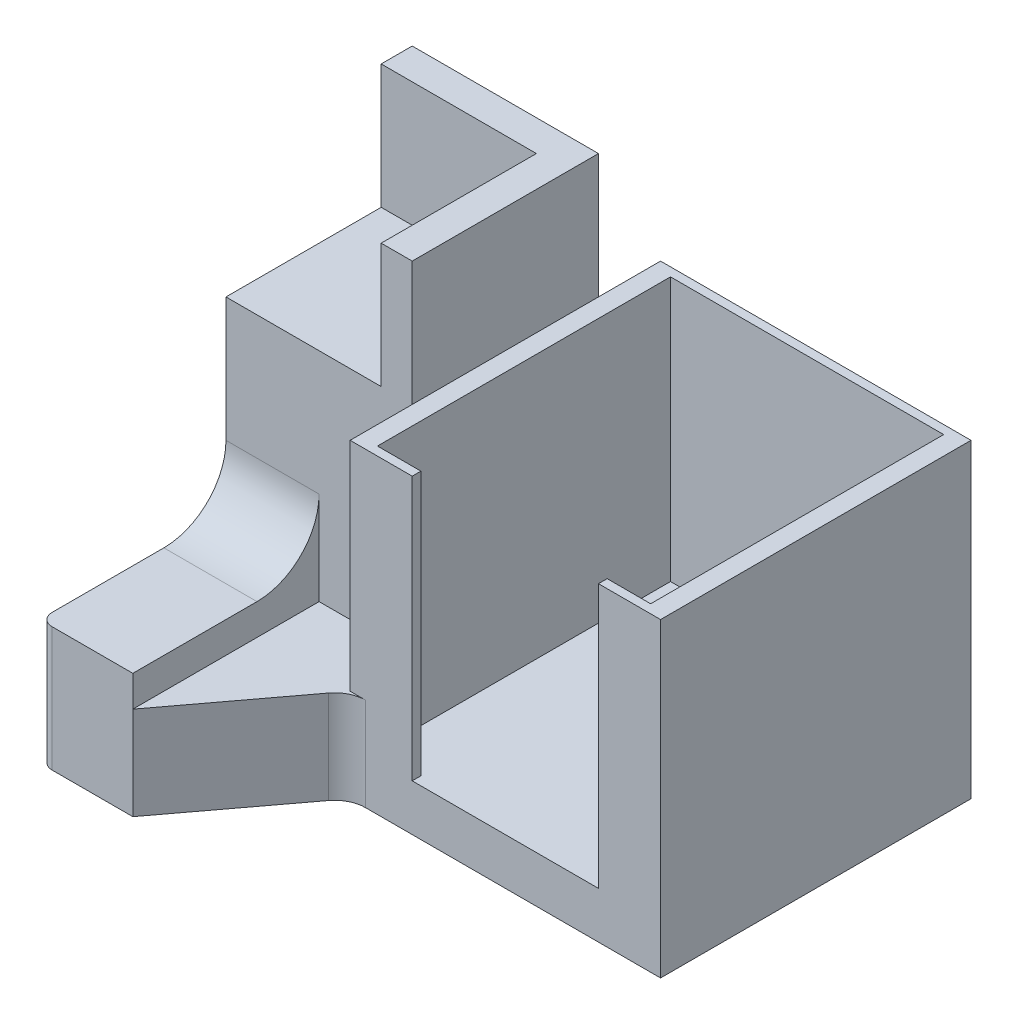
SolidWorks part; units mm, degrees
ref_plane "Alzado" through (0, 0, 0) normal (0, 0, 1) x (1, 0, 0)
ref_plane "Planta" through (0, 0, 0) normal (0, 1, 0) x (1, 0, 0)
ref_plane "Vista lateral" through (0, 0, 0) normal (1, 0, 0) x (0, 0, -1)
sketch "Croquis1" plane through (0, 0, 0) normal (0, 0, 1) x (1, 0, 0)
  line L1 (-25, -25) -> (25, -25)
  line L2 (-25, -25) -> (-25, 25)
  line L3 (-25, 25) -> (25, 25)
  line L4 (25, -25) -> (25, 25)
  line L5 (-25, -25) -> (25, 25) construction
  line L6 (-25, 25) -> (25, -25) construction
  point P0 (0, 0)
  dimension "D1" = 50
  dimension "D2" = 50
extrude "Saliente-Extruir1" add sketch "Croquis1" along normal blind 50
sketch "Croquis2" plane through (0, 25, 0) normal (0, 1, 0) x (1, 0, 0)
  line L0 (0, -25) -> (0, 0) construction
  line L1 (-22, -48.6) -> (-15, -48.6)
  line L2 (-22, -48.6) -> (-22, -1.4)
  line L3 (-22, -1.4) -> (22, -1.4)
  line L4 (22, -48.6) -> (22, -1.4)
  line L5 (-22, -48.6) -> (22, -1.4) construction
  line L6 (-22, -1.4) -> (22, -48.6) construction
  line L7 (-25, -25) -> (0, -25) construction
  line L8 (-25, -50) -> (-25, 0) construction
  line L9 (25, -50) -> (-25, -50) construction
  line L11 (-15, -48.6) -> (-15, -50)
  line L12 (-15, -50) -> (15, -50)
  line L13 (15, -48.6) -> (15, -50)
  line L14 (15, -48.6) -> (22, -48.6)
  point P0 (0, -25)
  dimension "D1" = 44
  dimension "D2" = 47.2
  dimension "D3" = 30
extrude "Cortar-Extruir1" cut sketch "Croquis2" against normal blind 42.5 contours L2 L3 L4 L14 L13 L12 L11 L1
sketch "Croquis5" plane through (-25, 0, 0) normal (-1, 0, 0) x (0, 0, 1)
  line L0 (25, 25) -> (25, -25) construction
  line L1 (50, 25) -> (0, 25) construction
  line L2 (50, -25) -> (0, -25) construction
  line L4 (10, 25) -> (40, 25)
  line L5 (10, 25) -> (10, -25)
  line L6 (10, -25) -> (40, -25)
  line L7 (40, 25) -> (40, -25)
  dimension "D1" = 30
extrude "Saliente-Extruir3" add sketch "Croquis5" along normal blind 30
sketch "Croquis6" plane through (0, -25, 0) normal (0, -1, 0) x (1, 0, 0)
  line L0 (-40, 40) -> (-40, 10) construction
  line L1 (-50, 35) -> (-30, 35)
  line L2 (-50, 35) -> (-50, 15)
  line L3 (-50, 15) -> (-30, 15)
  line L4 (-30, 35) -> (-30, 15)
  line L5 (-55, 40) -> (-25, 40) construction
  line L6 (-55, 10) -> (-25, 10) construction
  line L7 (-55, 25) -> (25, 25) construction
  line L8 (-55, 10) -> (-55, 40) construction
  line L9 (25, 50) -> (25, 0) construction
  dimension "D1" = 20
  dimension "D2" = 20
extrude "Cortar-Extruir3" cut sketch "Croquis6" against normal offset from surface (45 mm away) 5 contours L1 L4 L3 L2
sketch "Croquis7" plane through (-55, 0, 0) normal (-1, 0, 0) x (0, 0, 1)
  line L1 (40, -25) -> (70, -25)
  line L2 (40, -25) -> (40, -10)
  line L3 (40, -10) -> (70, -10)
  line L4 (70, -25) -> (70, -10)
  dimension "D1" = 30
  dimension "D2" = 15
extrude "Saliente-Extruir4" add sketch "Croquis7" against normal blind 15
sketch "Croquis8" plane through (-55, 0, 0) normal (-1, 0, 0) x (0, 0, 1)
  line L1 (40, -25) -> (40, 25) construction
  line L2 (10, -25) -> (70, -25) construction
  circle A0 centre (62.2, -15) radius 4.05
  dimension "D1" = 8.1
  dimension "D2" = 22.2
  dimension "D3" = 10
extrude "Cortar-Extruir4" cut sketch "Croquis8" against normal blind 10
sketch "Croquis9" plane through (0, -10, 0) normal (0, 1, 0) x (1, 0, 0)
  line L1 (-55, -40) -> (-40, -40)
  line L2 (-55, -40) -> (-55, -70)
  line L3 (-55, -70) -> (-40, -70)
  line L4 (-40, -40) -> (-40, -70)
extrude "Saliente-Extruir5" add sketch "Croquis9" along normal blind 5
fillet "Redondeo2" radius 10 1 edges at (-47.5, -5, 40)
fillet "Redondeo3" radius 2 1 edges at (-55, -15, 70)
sketch "Croquis10" plane through (0, -5, 0) normal (0, 1, 0) x (1, 0, 0)
  line L0 (-40, -70) -> (-25, -50)
  line L1 (-25, -50) -> (-25, -40)
  line L2 (-25, -40) -> (-40, -40)
  line L3 (-40, -40) -> (-40, -70)
extrude "Saliente-Extruir6" add sketch "Croquis10" against normal up to surface (15 mm away) from offset 5
fillet "Redondeo4" radius 5 1 edges at (-25, -17.5, 50)
sketch "Croquis11" plane through (0, 25, 0) normal (0, 1, 0) x (1, 0, 0)
  line L0 (-25, -10) -> (-25, -40)
  line L5 (-55, -10) -> (-25, -10) construction
  line L7 (-55, -10) -> (-25, -10)
  line L9 (-25, -40) -> (-30, -40)
  line L10 (-25, -40) -> (-40, -40) construction
  line L11 (-30, -40) -> (-30, -15)
  line L12 (-30, -15) -> (-55, -15)
  line L13 (-55, -40) -> (-55, -10) construction
  line L14 (-55, -15) -> (-55, -10)
  dimension "D1" = 5
  dimension "D2" = 5
extrude "Saliente-Extruir7" add sketch "Croquis11" along normal blind 20
